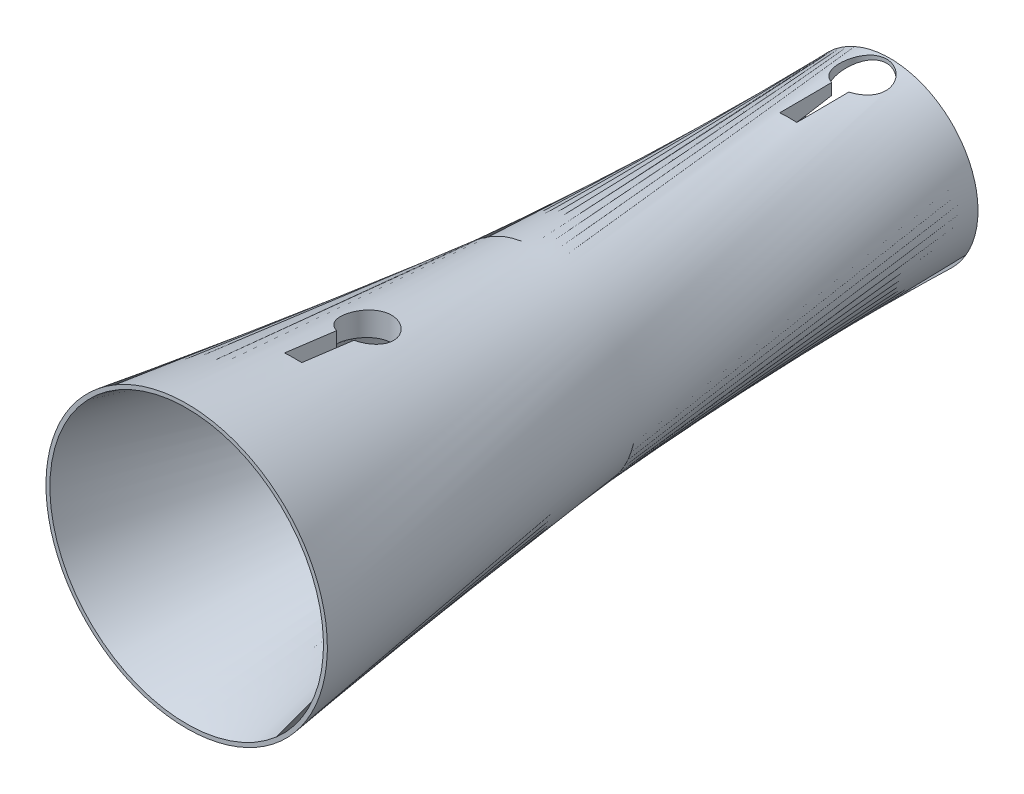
SolidWorks part; units mm, degrees
ref_plane "Front Plane" through (0, 0, 0) normal (0, 0, 1) x (1, 0, 0)
ref_plane "Top Plane" through (0, 0, 0) normal (0, 1, 0) x (1, 0, 0)
ref_plane "Right Plane" through (0, 0, 0) normal (1, 0, 0) x (0, 0, -1)
sketch "Sketch1" plane through (0, 0, 0) normal (0, 0, 1) x (1, 0, 0)
  circle A0 centre (0, 0) radius 33.75
  dimension "D1" = 67.5
ref_plane "Plane1" through (0, 0, 270) normal (0, 0, 1) x (1, 0, 0)
sketch "Sketch2" plane through (0, 0, 270) normal (0, 0, 1) x (1, 0, 0)
  circle A0 centre (0, 0) radius 54
  dimension "D1" = 108
loft "Loft2" add
sketch "Sketch3" plane through (0, 0, 270) normal (0, 0, 1) x (1, 0, 0)
  circle A0 centre (0, 0) radius 52.5
  dimension "D1" = 105
sketch "Sketch4" plane through (0, 0, 0) normal (0, 0, -1) x (-1, 0, 0)
  circle A0 centre (0, 0) radius 32.5
  dimension "D1" = 65
loft "Cut-Loft2" cut profiles "Sketch4", "Sketch3"
sketch "Sketch5" plane through (0, 0, 0) normal (0, 1, 0) x (1, 0, 0)
  line L0 (-3.8941, -228.5342) -> (-3.8941, -208.5342)
  line L1 (2.7059, -228.5342) -> (2.7059, -208.5342)
  line L2 (-3.8941, -38.5342) -> (-3.8941, -18.5342)
  line L3 (2.7059, -38.5342) -> (2.7059, -18.5342)
  line L4 (-3.8941, -228.5342) -> (2.7059, -228.5342)
  line L5 (-3.8941, -38.5342) -> (2.7059, -38.5342)
  arc A0 (2.7059, -208.5342) -> (-3.8941, -208.5342) centre (-0.5941, -200) ccw
  arc A1 (2.7059, -18.5342) -> (-3.8941, -18.5342) centre (-0.5941, -10) ccw
  point P11 (0, 0)
  point P12 (0, 0)
  point P13 (0, 0)
  dimension "D1" = 18.3
  dimension "D5" = 18.3
  dimension "D2" = 6.6
  dimension "D3" = 20
  dimension "D4" = 200
  dimension "D6" = 6.6
  dimension "D7" = 20
  dimension "D8" = 10
extrude "Cut-Extrude1" cut sketch "Sketch5" along normal through all
